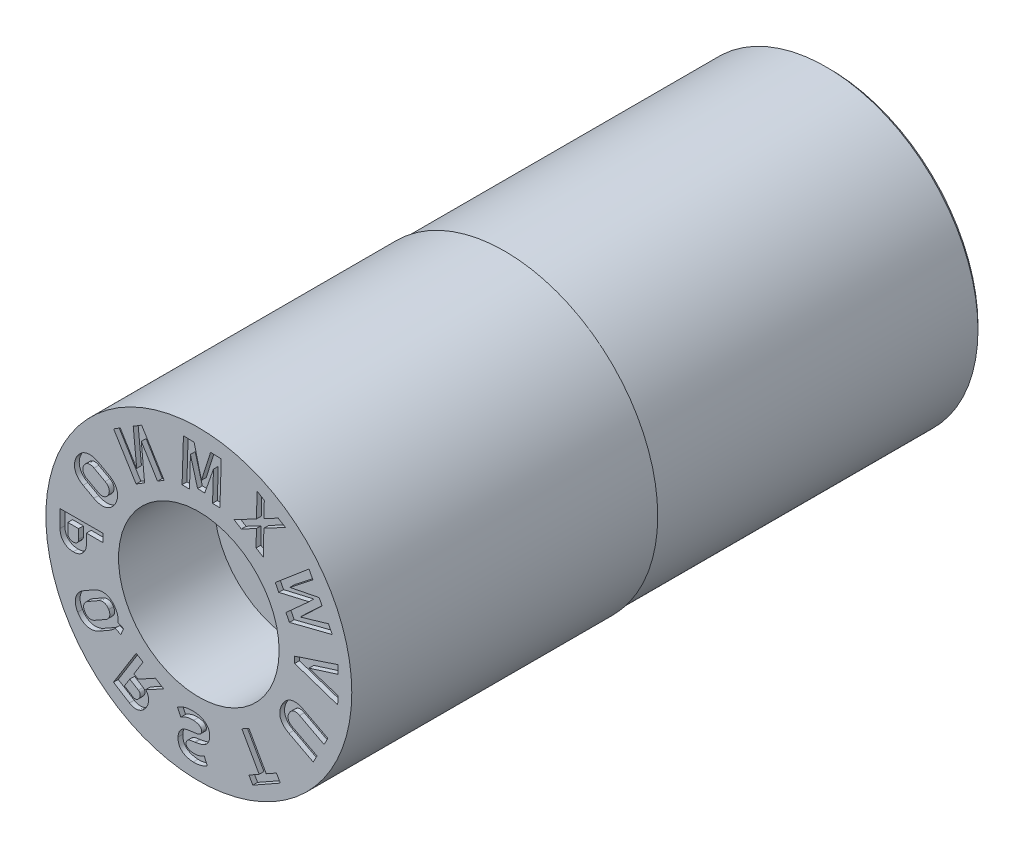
SolidWorks part; units mm, degrees
ref_plane "Front Plane" through (0, 0, 0) normal (0, 0, 1) x (1, 0, 0)
ref_plane "Top Plane" through (0, 0, 0) normal (0, 1, 0) x (1, 0, 0)
ref_plane "Right Plane" through (0, 0, 0) normal (1, 0, 0) x (0, 0, -1)
sketch "Sketch1" plane through (0, 0, 0) normal (1, 0, 0) x (0, 0, -1)
  line L2 (0, 8) -> (0, 4.2)
  line L3 (32.75, 8) -> (0, 8)
  line L4 (-3.7979, 0) -> (49996.2021, 0) construction
  line L8 (25, 1.75) -> (5, 1.75)
  line L9 (5, 4.2) -> (5, 1.75)
  line L10 (5, 4.2) -> (0, 4.2)
  line L12 (33, 4) -> (33, 7.75)
  line L16 (33, 7.75) -> (32.75, 8)
  line L17 (33, 4) -> (25, 4)
  line L18 (25, 1.75) -> (25, 4)
  dimension "D1" = 33
  dimension "D2" = 45
  dimension "D3" = 0.25
  dimension "D4" = 16
  dimension "D5" = 8.4
  dimension "D6" = 5
  dimension "D7" = 3.5
  dimension "D8" = 8
  dimension "D9" = 8
revolve "Revolve1" add sketch "Sketch1" angle 360 about L4
sketch "Sketch4" plane through (0, 0, 0) normal (1, 0, 0) x (0, 0, -1)
  line L0 (0, 0) -> (50000, 0) construction
  line L1 (33, -7.75) -> (33, 7.75) construction
  line L2 (16, 8.935) -> (33, 8.935)
  line L3 (16, 8.935) -> (16, 7.935)
  line L4 (16, 7.935) -> (33, 7.935)
  line L5 (33, 8.935) -> (33, 7.935)
  line L6 (32.75, 8) -> (0, 8) construction
  line L9 (0, 8.8) -> (0, -8.8) construction
  dimension "D1" = 1
  dimension "D2" = 0.065
  dimension "D3" = 16
revolve "Cut-Revolve1" cut sketch "Sketch4" angle 360 about L0
sketch "Sketch2" plane through (0, 0, 0) normal (0, 0, 1) x (1, 0, 0)
  line L0 (0, 0) -> (0, 8) construction
  line L1 (0, 0) -> (4, 6.9282) construction
  line L2 (0, 0) -> (6.9282, 4) construction
  line L3 (0, 0) -> (8, 0) construction
  line L4 (0, 0) -> (6.9282, -4) construction
  line L5 (0, 0) -> (4, -6.9282) construction
  line L6 (0, 0) -> (0, -8) construction
  line L7 (0, 0) -> (-4, -6.9282) construction
  line L8 (0, 0) -> (-6.9282, -4) construction
  line L9 (0, 0) -> (-8, 0) construction
  line L10 (0, 0) -> (-6.9282, 4) construction
  line L11 (0, 0) -> (-4, 6.9282) construction
  line L12 (6.4488, 3.1517) -> (6.2927, 3.4546)
  line L13 (6.2927, 3.4546) -> (4.7601, 3.1497)
  line L14 (4.7601, 3.1497) -> (5.9631, 4.095)
  line L15 (5.9631, 4.095) -> (5.7632, 4.4834)
  line L16 (5.7632, 4.4834) -> (3.9985, 2.9908)
  line L17 (3.9985, 2.9908) -> (4.1813, 2.6355)
  line L18 (4.1813, 2.6355) -> (5.7635, 3.0009)
  line L19 (5.7635, 3.0009) -> (4.556, 1.9087)
  line L20 (4.556, 1.9087) -> (4.7388, 1.5533)
  line L21 (4.7388, 1.5533) -> (6.9783, 2.1228)
  line L22 (6.9783, 2.1228) -> (6.7784, 2.5113)
  line L23 (6.7784, 2.5113) -> (5.3101, 2.0809)
  line L24 (5.3101, 2.0809) -> (6.4488, 3.1517)
  line L25 (3.1563, -6.1177) -> (2.6213, -6.4193)
  line L26 (3.4004, 5.1489) -> (4.5318, 5.7499)
  line L27 (4.5318, 5.7499) -> (4.1504, 5.9824)
  line L28 (4.1504, 5.9824) -> (3.4083, 5.5883)
  line L29 (-3.1769, -4.9777) -> (-3.3944, -4.8422)
  line L30 (3.0187, 5.3802) -> (1.8422, 4.7562)
  line L31 (1.8422, 4.7562) -> (2.2238, 4.5234)
  line L32 (2.2238, 4.5234) -> (3.0109, 4.942)
  line L33 (3.4083, 5.5883) -> (3.4236, 6.4254)
  line L34 (3.4236, 6.4254) -> (3.042, 6.6583)
  line L35 (3.042, 6.6583) -> (3.0187, 5.3802)
  line L36 (3.0109, 4.942) -> (2.9951, 4.0531)
  line L37 (2.9951, 4.0531) -> (3.3767, 3.8203)
  line L38 (3.3767, 3.8203) -> (3.4004, 5.1489)
  line L39 (-0.2451, 7.2204) -> (-0.8048, 7.2379)
  line L40 (-0.8048, 7.2379) -> (-0.8743, 4.9851)
  line L41 (-0.8743, 4.9851) -> (-0.4882, 4.9734)
  line L42 (-0.4882, 4.9734) -> (-0.4388, 6.5719)
  line L43 (-3.3944, -4.8422) -> (-2.9167, -4.0755)
  line L44 (-0.4388, 6.5719) -> (-0.0653, 5.2113)
  line L45 (-0.0653, 5.2113) -> (0.3098, 5.1998)
  line L46 (0.3098, 5.1998) -> (0.766, 6.5083)
  line L47 (-5.8797, 0.289) -> (-5.0054, 0.2907)
  line L48 (0.766, 6.5083) -> (0.7173, 4.9359)
  line L49 (0.7173, 4.9359) -> (1.103, 4.9242)
  line L50 (1.103, 4.9242) -> (1.1726, 7.177)
  line L51 (1.1726, 7.177) -> (0.6134, 7.194)
  line L52 (0.6134, 7.194) -> (0.1374, 5.6892)
  line L53 (0.1374, 5.6892) -> (-0.2451, 7.2204)
  line L54 (-2.9895, 6.624) -> (-3.4305, 6.353)
  line L55 (-3.4305, 6.353) -> (-3.2499, 4.5344)
  line L57 (-3.2499, 4.5344) -> (-4.1103, 5.9352)
  line L58 (-4.1103, 5.9352) -> (-4.4551, 5.7231)
  line L59 (-4.4551, 5.7231) -> (-3.2803, 3.8113)
  line L60 (-3.2803, 3.8113) -> (-2.8369, 4.084)
  line L61 (-2.8369, 4.084) -> (-3.0069, 5.88)
  line L63 (-3.0069, 5.88) -> (-2.1593, 4.5005)
  line L64 (-2.1593, 4.5005) -> (-1.8148, 4.7122)
  line L65 (-1.8148, 4.7122) -> (-2.9895, 6.624)
  line L66 (-4.698, 3.5076) -> (-5.2593, 3.8155)
  line L67 (-6.0526, 2.368) -> (-5.4913, 2.0601)
  line L68 (-5.2693, 2.4418) -> (-5.8502, 2.7599)
  line L69 (-5.4811, 3.4334) -> (-4.9001, 3.1152)
  line L70 (-6.2889, 0.2881) -> (-6.2881, -0.2013)
  line L71 (-6.8488, -0.2025) -> (-6.8496, 0.287)
  line L73 (-7.2597, 0.7109) -> (-7.258, -0.1928)
  line L74 (-5.879, -0.1898) -> (-5.8797, 0.289)
  line L77 (-6.8496, 0.287) -> (-6.2889, 0.2881)
  line L78 (-5.0054, 0.2907) -> (-5.0064, 0.7155)
  line L79 (-5.0064, 0.7155) -> (-7.2597, 0.7109)
  line L81 (-4.3848, -3.2727) -> (-4.074, -3.4053)
  line L82 (-4.074, -3.4053) -> (-3.9364, -3.0669)
  line L83 (-3.9364, -3.0669) -> (-4.2324, -2.9411)
  line L84 (-5.4709, -2.0766) -> (-6.0236, -2.3918)
  line L85 (-5.2103, -3.8157) -> (-4.6577, -3.5005)
  line L86 (-4.8657, -3.1144) -> (-5.4372, -3.4405)
  line L87 (-5.8155, -2.7779) -> (-5.244, -2.4518)
  line L88 (-3.6097, -5.1879) -> (-3.1634, -5.466)
  line L89 (-3.4425, -5.9138) -> (-3.8888, -5.6357)
  line L94 (-4.4632, -5.7578) -> (-3.6292, -6.2777)
  line L95 (-3.8888, -5.6357) -> (-3.6097, -5.1879)
  line L96 (-2.9167, -4.0755) -> (-3.2757, -3.8518)
  line L97 (-3.2757, -3.8518) -> (-4.4632, -5.7578)
  line L99 (-2.7792, -5.2514) -> (-1.8346, -4.7498)
  line L100 (-1.8346, -4.7498) -> (-2.2696, -4.4786)
  line L101 (-2.2696, -4.4786) -> (-3.1769, -4.9777)
  line L102 (-1.1164, -5.2148) -> (-0.94, -5.5761)
  line L103 (0.1443, -5.6846) -> (0.1442, -5.686)
  line L104 (-0.2833, -5.9301) -> (-0.3172, -5.9329)
  line L105 (-1.0856, -6.5477) -> (-1.0858, -6.5495)
  line L106 (0.4412, -7.0932) -> (0.2821, -6.7239)
  line L107 (-0.6669, -6.6131) -> (-0.6668, -6.6118)
  line L108 (0.5649, -5.7198) -> (0.5647, -5.7165)
  line L110 (3.5259, -5.9094) -> (2.6203, -4.3023)
  line L111 (2.6203, -4.3023) -> (2.2508, -4.5108)
  line L112 (2.2508, -4.5108) -> (3.1563, -6.1177)
  line L113 (2.8222, -6.7759) -> (4.2615, -5.9646)
  line L114 (4.2615, -5.9646) -> (4.0606, -5.608)
  line L115 (4.0606, -5.608) -> (3.5259, -5.9094)
  line L116 (2.6213, -6.4193) -> (2.8222, -6.7759)
  line L117 (4.7119, -3.4825) -> (5.9837, -4.1508)
  line L118 (5.9837, -4.1508) -> (6.1811, -3.7754)
  line L119 (6.1811, -3.7754) -> (4.8997, -3.1024)
  line L120 (5.2697, -2.3976) -> (6.5511, -3.0707)
  line L121 (6.5511, -3.0707) -> (6.7483, -2.6948)
  line L122 (6.7483, -2.6948) -> (5.4765, -2.0265)
  line L123 (7.2657, -0.9258) -> (7.267, -0.4886)
  line L124 (7.267, -0.4886) -> (5.7651, -0.0058)
  line L125 (5.7651, -0.0058) -> (7.2693, 0.4689)
  line L126 (7.2693, 0.4689) -> (7.2706, 0.906)
  line L127 (7.2706, 0.906) -> (5.0153, 0.1623)
  line L128 (5.0153, 0.1623) -> (5.0142, -0.1697)
  line L129 (5.0142, -0.1697) -> (7.2657, -0.9258)
  circle A0 centre (0, 0) radius 5.0987 construction
  circle A1 centre (0, 0) radius 8 construction
  spline S0 degree 3 poles (-4.3634, 2.3836) (-4.344, 2.4183) (-4.3186, 2.4716) (-4.2912, 2.5443) (-4.2747, 2.598) (-4.2619, 2.6517) (-4.2525, 2.7053) (-4.2476, 2.7591) (-4.2456, 2.8123) (-4.2478, 2.8652) (-4.2532, 2.9172) (-4.262, 2.9684) (-4.2759, 3.0182) (-4.2915, 3.0674) (-4.3119, 3.1153) (-4.336, 3.162) (-4.3628, 3.2081) (-4.394, 3.2518) (-4.4275, 3.2946) (-4.4649, 3.3349) (-4.5055, 3.3733) (-4.5486, 3.4104) (-4.6119, 3.4569) (-4.6627, 3.4882) (-4.698, 3.5076) knots 0 0 0 0 0.090417 0.133864 0.176276 0.217818 0.259154 0.299759 0.340251 0.380131 0.419768 0.458883 0.497906 0.537021 0.576163 0.61597 0.656312 0.697015 0.737895 0.779553 0.821787 0.864666 0.908561 1 1 1 1
  spline S1 degree 3 poles (-5.2593, 3.8155) (-5.2948, 3.8344) (-5.3481, 3.8615) (-5.4218, 3.8885) (-5.4759, 3.9057) (-5.5301, 3.9189) (-5.5842, 3.9287) (-5.6382, 3.9339) (-5.6918, 3.9365) (-5.7449, 3.9342) (-5.7971, 3.9299) (-5.8482, 3.9204) (-5.8983, 3.908) (-5.9475, 3.8921) (-5.9953, 3.8721) (-6.0425, 3.8495) (-6.088, 3.8223) (-6.1319, 3.7919) (-6.1746, 3.7589) (-6.2148, 3.7221) (-6.2532, 3.6823) (-6.2896, 3.6393) (-6.3361, 3.5771) (-6.3671, 3.527) (-6.3862, 3.4921) knots 0 0 0 0 0.091509 0.13546 0.178154 0.220455 0.262042 0.302878 0.343583 0.383955 0.423455 0.462585 0.501839 0.540633 0.57985 0.619401 0.659411 0.700117 0.740632 0.781904 0.823734 0.866298 0.909762 1 1 1 1
  spline S2 degree 3 poles (-6.3862, 3.4921) (-6.4056, 3.4574) (-6.431, 3.404) (-6.4584, 3.3313) (-6.4748, 3.2775) (-6.4883, 3.224) (-6.4968, 3.1701) (-6.5025, 3.1165) (-6.5043, 3.0629) (-6.5026, 3.0099) (-6.4964, 2.9578) (-6.4875, 2.9068) (-6.4748, 2.8569) (-6.4583, 2.808) (-6.4379, 2.7603) (-6.4148, 2.7132) (-6.387, 2.668) (-6.3569, 2.6235) (-6.3224, 2.5815) (-6.2858, 2.5405) (-6.2451, 2.5023) (-6.202, 2.4651) (-6.1387, 2.4186) (-6.0879, 2.3874) (-6.0526, 2.368) knots 0 0 0 0 0.090428 0.133879 0.176296 0.218093 0.259201 0.300026 0.340522 0.380882 0.420369 0.459489 0.498292 0.537327 0.576473 0.615974 0.65631 0.697004 0.737925 0.779528 0.821767 0.864651 0.908551 1 1 1 1
  spline S3 degree 3 poles (-5.4913, 2.0601) (-5.4558, 2.0412) (-5.4025, 2.014) (-5.3287, 1.9871) (-5.2747, 1.9693) (-5.2204, 1.9568) (-5.1662, 1.9468) (-5.112, 1.9414) (-5.0582, 1.9392) (-5.0051, 1.9401) (-4.9529, 1.946) (-4.9017, 1.9545) (-4.8515, 1.9668) (-4.8024, 1.983) (-4.7543, 2.0027) (-4.7074, 2.0262) (-4.6617, 2.0532) (-4.6177, 2.0837) (-4.575, 2.1167) (-4.5348, 2.1535) (-4.4964, 2.1934) (-4.46, 2.2363) (-4.4135, 2.2985) (-4.3825, 2.3487) (-4.3634, 2.3836) knots 0 0 0 0 0.091419 0.135326 0.178245 0.220253 0.261799 0.303083 0.343748 0.38396 0.423573 0.462799 0.501686 0.540778 0.579956 0.619429 0.659747 0.700413 0.740888 0.782119 0.823908 0.86643 0.909851 1 1 1 1
  spline S4 degree 3 poles (-4.7373, 2.5883) (-4.7555, 2.5571) (-4.7846, 2.5116) (-4.8359, 2.4637) (-4.8762, 2.4335) (-4.9202, 2.4108) (-4.966, 2.3936) (-5.0144, 2.3847) (-5.0644, 2.3823) (-5.1157, 2.386) (-5.186, 2.402) (-5.2369, 2.4233) (-5.2693, 2.4418) knots 0 0 0 0 0.175066 0.257026 0.337672 0.416954 0.494877 0.572754 0.653437 0.735689 0.820268 1 1 1 1
  spline S5 degree 3 poles (-5.8502, 2.7599) (-5.883, 2.7776) (-5.9281, 2.8092) (-5.9796, 2.8595) (-6.0105, 2.9007) (-6.036, 2.9439) (-6.0534, 2.9899) (-6.0648, 3.0375) (-6.0683, 3.0869) (-6.0652, 3.1371) (-6.052, 3.2062) (-6.03, 3.2556) (-6.013, 3.2876) knots 0 0 0 0 0.179291 0.263984 0.346173 0.426703 0.505006 0.582502 0.662079 0.742384 0.824865 1 1 1 1
  spline S6 degree 3 poles (-6.013, 3.2876) (-5.9956, 3.3194) (-5.9648, 3.3634) (-5.9144, 3.4123) (-5.8741, 3.4421) (-5.8303, 3.465) (-5.7844, 3.4814) (-5.736, 3.4905) (-5.6859, 3.493) (-5.6346, 3.4889) (-5.5645, 3.4722) (-5.5134, 3.4521) (-5.4811, 3.4334) knots 0 0 0 0 0.175013 0.257189 0.337906 0.416522 0.494678 0.572624 0.653378 0.736149 0.820282 1 1 1 1
  spline S7 degree 3 poles (-4.9001, 3.1152) (-4.8673, 3.0974) (-4.8223, 3.0658) (-4.7706, 3.0156) (-4.7399, 2.9745) (-4.7144, 2.9313) (-4.6969, 2.8853) (-4.6856, 2.8378) (-4.6819, 2.7888) (-4.6849, 2.7385) (-4.6989, 2.6696) (-4.7198, 2.62) (-4.7373, 2.5883) knots 0 0 0 0 0.180158 0.264225 0.346507 0.427127 0.505518 0.583101 0.661767 0.742163 0.825247 1 1 1 1
  spline S8 degree 3 poles (-6.2881, -0.2013) (-6.2881, -0.2253) (-6.2916, -0.2611) (-6.3064, -0.3056) (-6.3216, -0.336) (-6.3407, -0.3637) (-6.3636, -0.3883) (-6.3903, -0.4095) (-6.4204, -0.4273) (-6.4534, -0.4418) (-6.5019, -0.4558) (-6.5403, -0.4595) (-6.5663, -0.4595) knots 0 0 0 0 0.169434 0.250086 0.328532 0.407346 0.485755 0.563905 0.646402 0.730758 0.816935 1 1 1 1
  spline S9 degree 3 poles (-6.5663, -0.4595) (-6.5926, -0.4598) (-6.6315, -0.4565) (-6.6808, -0.443) (-6.7143, -0.4291) (-6.7447, -0.4114) (-6.7716, -0.3905) (-6.7948, -0.3662) (-6.8143, -0.3386) (-6.8298, -0.3082) (-6.8444, -0.2631) (-6.8485, -0.227) (-6.8488, -0.2025) knots 0 0 0 0 0.183737 0.270259 0.35493 0.436774 0.514306 0.592094 0.670285 0.749063 0.828741 1 1 1 1
  spline S10 degree 3 poles (-7.258, -0.1928) (-7.2583, -0.2595) (-7.2474, -0.3573) (-7.2114, -0.4805) (-7.1735, -0.5639) (-7.1257, -0.6395) (-7.069, -0.707) (-7.0031, -0.765) (-6.9291, -0.814) (-6.8472, -0.8526) (-6.7267, -0.8904) (-6.6303, -0.8991) (-6.5653, -0.8994) knots 0 0 0 0 0.179428 0.263192 0.344951 0.425149 0.503595 0.58156 0.660922 0.741878 0.824548 1 1 1 1
  spline S11 degree 3 poles (-6.5653, -0.8994) (-6.5003, -0.8992) (-6.4042, -0.8899) (-6.2843, -0.8514) (-6.2034, -0.8122) (-6.1297, -0.7634) (-6.0641, -0.7053) (-6.008, -0.6375) (-5.9612, -0.5612) (-5.9239, -0.4775) (-5.8875, -0.3543) (-5.8788, -0.2562) (-5.879, -0.1898) knots 0 0 0 0 0.17567 0.257978 0.338538 0.417594 0.495743 0.574022 0.654373 0.736457 0.820616 1 1 1 1
  spline S12 degree 3 poles (-4.3457, -2.3777) (-4.3651, -2.3434) (-4.3973, -2.2944) (-4.444, -2.2331) (-4.4811, -2.1911) (-4.52, -2.1525) (-4.5608, -2.1168) (-4.6035, -2.0844) (-4.6479, -2.0552) (-4.6937, -2.0297) (-4.7405, -2.0071) (-4.7883, -1.9882) (-4.8374, -1.9732) (-4.8873, -1.9615) (-4.9386, -1.9541) (-4.9905, -1.9498) (-5.0434, -1.9492) (-5.0967, -1.9516) (-5.1502, -1.9592) (-5.2039, -1.9689) (-5.2574, -1.9833) (-5.3109, -2.0009) (-5.3832, -2.0302) (-5.4362, -2.0566) (-5.4709, -2.0766) knots 0 0 0 0 0.090234 0.133861 0.176167 0.218114 0.259198 0.299947 0.340551 0.380505 0.419966 0.45916 0.497959 0.537253 0.576271 0.616191 0.656407 0.697093 0.738095 0.779698 0.821795 0.864815 0.90843 1 1 1 1
  spline S13 degree 3 poles (-6.0236, -2.3918) (-6.0582, -2.4118) (-6.1083, -2.4437) (-6.17, -2.4914) (-6.2126, -2.5284) (-6.2519, -2.5675) (-6.2882, -2.6084) (-6.3211, -2.6511) (-6.3508, -2.6955) (-6.3771, -2.7414) (-6.3996, -2.7885) (-6.4192, -2.8363) (-6.4342, -2.8853) (-6.446, -2.9352) (-6.4549, -2.9859) (-6.4591, -3.0378) (-6.4604, -3.0905) (-6.4576, -3.1435) (-6.4513, -3.1967) (-6.4414, -3.2497) (-6.4271, -3.3028) (-6.41, -3.3559) (-6.3814, -3.4276) (-6.3553, -3.4801) (-6.3354, -3.5142) knots 0 0 0 0 0.09146 0.135407 0.17814 0.220498 0.261975 0.303097 0.343701 0.38398 0.423782 0.462904 0.502035 0.540876 0.579933 0.619684 0.659711 0.700389 0.74094 0.78204 0.823635 0.866377 0.909701 1 1 1 1
  spline S14 degree 3 poles (-6.3354, -3.5142) (-6.3159, -3.5486) (-6.2837, -3.5975) (-6.237, -3.659) (-6.1997, -3.7008) (-6.161, -3.7396) (-6.1201, -3.775) (-6.0779, -3.808) (-6.0333, -3.8371) (-5.9873, -3.8628) (-5.9404, -3.8855) (-5.8926, -3.9043) (-5.8436, -3.9194) (-5.7936, -3.9308) (-5.7427, -3.9385) (-5.6908, -3.9429) (-5.638, -3.9437) (-5.5846, -3.9403) (-5.5311, -3.9341) (-5.4774, -3.9237) (-5.4241, -3.909) (-5.3703, -3.8917) (-5.2978, -3.8627) (-5.2451, -3.8353) (-5.2103, -3.8157) knots 0 0 0 0 0.090218 0.133837 0.176472 0.21807 0.259147 0.29992 0.340517 0.380813 0.420268 0.459455 0.498247 0.537204 0.576536 0.615976 0.656185 0.697067 0.738109 0.779449 0.821796 0.864538 0.908634 1 1 1 1
  spline S15 degree 3 poles (-4.6577, -3.5005) (-4.623, -3.4805) (-4.573, -3.4486) (-4.5112, -3.4009) (-4.4687, -3.3637) (-4.4293, -3.3247) (-4.402, -3.2939) (-4.3877, -3.2763) (-4.3848, -3.2727) knots 0 0 0 0 0.091434 0.135369 0.178426 0.220431 0.261896 0.272358 0.272358 0.272358 0.272358
  spline S16 degree 3 poles (-4.7134, -2.5876) (-4.6956, -2.619) (-4.6737, -2.6678) (-4.6587, -2.7361) (-4.6547, -2.786) (-4.6578, -2.8349) (-4.6672, -2.8825) (-4.6849, -2.9281) (-4.7086, -2.9718) (-4.7389, -3.0127) (-4.7888, -3.064) (-4.8332, -3.0964) (-4.8657, -3.1144) knots 0 0 0 0 0.175071 0.257562 0.338258 0.41707 0.494906 0.573014 0.653432 0.735383 0.819614 1 1 1 1
  spline S17 degree 3 poles (-5.4372, -3.4405) (-5.4692, -3.4592) (-5.5192, -3.4813) (-5.5888, -3.4983) (-5.6397, -3.5033) (-5.6895, -3.5023) (-5.7375, -3.4933) (-5.7835, -3.478) (-5.8272, -3.4557) (-5.8683, -3.4271) (-5.9189, -3.379) (-5.9507, -3.336) (-5.9683, -3.3044) knots 0 0 0 0 0.179631 0.263716 0.346819 0.427114 0.504808 0.582853 0.661977 0.742324 0.824817 1 1 1 1
  spline S18 degree 3 poles (-5.9683, -3.3044) (-5.9867, -3.2734) (-6.0071, -3.2243) (-6.023, -3.1565) (-6.0267, -3.1067) (-6.024, -3.0577) (-6.0134, -3.0102) (-5.9966, -2.9642) (-5.9726, -2.9204) (-5.9422, -2.8793) (-5.8924, -2.8279) (-5.8475, -2.7965) (-5.8155, -2.7779) knots 0 0 0 0 0.174598 0.256604 0.33734 0.416193 0.494507 0.572807 0.653266 0.736 0.820274 1 1 1 1
  spline S19 degree 3 poles (-5.244, -2.4518) (-5.2121, -2.4329) (-5.1617, -2.4114) (-5.0923, -2.3942) (-5.0416, -2.3894) (-4.9919, -2.3903) (-4.944, -2.3997) (-4.8978, -2.4147) (-4.8542, -2.437) (-4.8133, -2.4657) (-4.762, -2.5128) (-4.7316, -2.5568) (-4.7134, -2.5876) knots 0 0 0 0 0.180338 0.264553 0.346739 0.427158 0.505663 0.583106 0.662351 0.742822 0.825304 1 1 1 1
  spline S20 degree 3 poles (-3.1634, -5.466) (-3.1458, -5.4768) (-3.1218, -5.4961) (-3.097, -5.5281) (-3.083, -5.5539) (-3.0727, -5.5816) (-3.0658, -5.6108) (-3.0647, -5.6418) (-3.0668, -5.6738) (-3.0738, -5.7065) (-3.0875, -5.7521) (-3.1042, -5.7848) (-3.1171, -5.8061) knots 0 0 0 0 0.160612 0.237098 0.313463 0.389061 0.466581 0.546139 0.629588 0.716199 0.805606 1 1 1 1
  spline S21 degree 3 poles (-3.1171, -5.8061) (-3.1297, -5.8274) (-3.1525, -5.8557) (-3.1858, -5.8895) (-3.2123, -5.9096) (-3.24, -5.9256) (-3.2681, -5.9382) (-3.2974, -5.9455) (-3.3267, -5.9487) (-3.3564, -5.9469) (-3.3964, -5.9385) (-3.4248, -5.925) (-3.4425, -5.9138) knots 0 0 0 0 0.191933 0.281905 0.367825 0.450098 0.529993 0.606815 0.683304 0.759048 0.836941 1 1 1 1
  spline S22 degree 3 poles (-3.6292, -6.2777) (-3.5794, -6.3082) (-3.5012, -6.347) (-3.3905, -6.3732) (-3.3087, -6.3812) (-3.2278, -6.3774) (-3.1485, -6.3616) (-3.0715, -6.3346) (-2.9976, -6.2956) (-2.9268, -6.2466) (-2.8378, -6.1638) (-2.7803, -6.0904) (-2.7476, -6.0363) knots 0 0 0 0 0.170748 0.251497 0.330741 0.409456 0.486886 0.565662 0.64645 0.72983 0.816027 1 1 1 1
  spline S23 degree 3 poles (-2.7476, -6.0363) (-2.7148, -5.9824) (-2.6714, -5.8995) (-2.6381, -5.7824) (-2.6241, -5.6971) (-2.6225, -5.6133) (-2.6314, -5.5319) (-2.653, -5.4541) (-2.6855, -5.3797) (-2.7277, -5.3115) (-2.7616, -5.2703) (-2.7792, -5.2514) knots 0 0 0 0 0.184404 0.270267 0.353973 0.435404 0.513884 0.591754 0.669953 0.749645 0.824899 0.824899 0.824899 0.824899
  spline S24 degree 3 poles (-0.2539, -4.9842) (-0.3072, -4.9806) (-0.3869, -4.9807) (-0.4925, -4.9882) (-0.5706, -4.9979) (-0.6472, -5.0121) (-0.7221, -5.0295) (-0.7947, -5.0515) (-0.8652, -5.0771) (-0.9329, -5.1065) (-1.0187, -5.1488) (-1.0786, -5.1871) (-1.1164, -5.2148) knots 0 0 0 0 0.175816 0.262253 0.349054 0.434999 0.519088 0.602387 0.684996 0.76606 0.845593 1 1 1 1
  spline S25 degree 3 poles (-0.94, -5.5761) (-0.8945, -5.5425) (-0.8206, -5.4991) (-0.7146, -5.4542) (-0.6304, -5.4273) (-0.5435, -5.407) (-0.4259, -5.3884) (-0.3364, -5.3873) (-0.2772, -5.3902) knots 0 0 0 0 0.241564 0.36485 0.491535 0.619246 0.746088 1 1 1 1
  spline S26 degree 3 poles (-0.2772, -5.3902) (-0.2445, -5.3927) (-0.1967, -5.3962) (-0.1359, -5.4079) (-0.0943, -5.4174) (-0.056, -5.4297) (-0.0207, -5.4442) (0.0119, -5.4598) (0.0408, -5.4784) (0.0671, -5.498) (0.0891, -5.5202) (0.1079, -5.5436) (0.1229, -5.5687) (0.1338, -5.5954) (0.1444, -5.6337) (0.1456, -5.6642) (0.1443, -5.6846) knots 0 0 0 0 0.170714 0.249203 0.322517 0.39276 0.45861 0.520967 0.580889 0.637532 0.691348 0.743244 0.793496 0.843085 0.893306 1 1 1 1
  spline S27 degree 3 poles (0.1442, -5.686) (0.1425, -5.7132) (0.135, -5.753) (0.1102, -5.7991) (0.0857, -5.8268) (0.0566, -5.8499) (0.0235, -5.8689) (-0.0129, -5.8847) (-0.0535, -5.8965) (-0.0987, -5.9061) (-0.1698, -5.9172) (-0.226, -5.9245) (-0.2655, -5.928) knots 0 0 0 0 0.155958 0.226205 0.294878 0.365125 0.436938 0.511413 0.590371 0.677175 0.774387 1 1 1 1
  spline S28 degree 3 poles (-0.2655, -5.928) (-0.2685, -5.9286) (-0.2743, -5.93) (-0.2804, -5.9294) (-0.2833, -5.9301) knots 0 0 0 0 0.505222 1 1 1 1
  spline S29 degree 3 poles (-0.3172, -5.9329) (-0.3871, -5.9406) (-0.4876, -5.9524) (-0.6139, -5.9782) (-0.696, -5.9989) (-0.7712, -6.0264) (-0.8403, -6.0653) (-0.904, -6.1142) (-0.9525, -6.1629) (-0.9873, -6.2076) (-1.0105, -6.2454) (-1.0312, -6.2866) (-1.048, -6.3318) (-1.0622, -6.3806) (-1.0777, -6.4525) (-1.0831, -6.509) (-1.0856, -6.5477) knots 0 0 0 0 0.19074 0.273951 0.349023 0.420088 0.490514 0.56274 0.637321 0.676109 0.715999 0.757372 0.800855 0.8465 0.894975 1 1 1 1
  spline S30 degree 3 poles (-1.0858, -6.5495) (-1.0879, -6.5847) (-1.0883, -6.6367) (-1.0813, -6.7046) (-1.0733, -6.7529) (-1.0626, -6.7997) (-1.0481, -6.8444) (-1.0309, -6.8874) (-1.0102, -6.9284) (-0.9865, -6.9676) (-0.96, -7.0046) (-0.9307, -7.0396) (-0.8981, -7.0718) (-0.8629, -7.1027) (-0.8245, -7.1308) (-0.7835, -7.1575) (-0.7394, -7.1811) (-0.6929, -7.2032) (-0.6436, -7.2223) (-0.5918, -7.2392) (-0.5375, -7.2532) (-0.4806, -7.2654) (-0.4, -7.2794) (-0.3375, -7.2842) (-0.2952, -7.2871) knots 0 0 0 0 0.086122 0.126937 0.166794 0.205856 0.244094 0.281595 0.319089 0.356297 0.393447 0.430238 0.467716 0.505529 0.544495 0.584174 0.624919 0.666716 0.709957 0.754089 0.799996 0.84712 0.896298 1 1 1 1
  spline S31 degree 3 poles (-0.2952, -7.2871) (-0.2546, -7.2896) (-0.1927, -7.2897) (-0.1099, -7.2825) (-0.0251, -7.2714) (0.0808, -7.2484) (0.2473, -7.1957) (0.366, -7.1381) (0.4412, -7.0932) knots 0 0 0 0 0.158254 0.239769 0.322694 0.490228 0.659934 1 1 1 1
  spline S32 degree 3 poles (0.2821, -6.7239) (0.2381, -6.7515) (0.1693, -6.7867) (0.0746, -6.8253) (0.0035, -6.8488) (-0.0675, -6.866) (-0.159, -6.8815) (-0.2275, -6.8838) (-0.272, -6.8816) knots 0 0 0 0 0.266015 0.396017 0.524444 0.649904 0.7709 1 1 1 1
  spline S33 degree 3 poles (-0.272, -6.8816) (-0.3028, -6.8797) (-0.3473, -6.8751) (-0.4047, -6.8659) (-0.4433, -6.8561) (-0.4793, -6.845) (-0.5125, -6.8323) (-0.5429, -6.8177) (-0.5701, -6.8007) (-0.5944, -6.7825) (-0.6152, -6.7626) (-0.6326, -6.7412) (-0.6466, -6.7184) (-0.657, -6.694) (-0.6663, -6.6591) (-0.668, -6.6316) (-0.6669, -6.6131) knots 0 0 0 0 0.172995 0.251527 0.326367 0.39674 0.462928 0.526374 0.586019 0.642841 0.696728 0.747231 0.797654 0.846549 0.896098 1 1 1 1
  spline S34 degree 3 poles (-0.6668, -6.6118) (-0.6646, -6.5824) (-0.6578, -6.5387) (-0.6296, -6.4896) (-0.6028, -6.4601) (-0.5717, -6.4353) (-0.5371, -6.415) (-0.4998, -6.3978) (-0.4581, -6.3851) (-0.411, -6.3743) (-0.3331, -6.3589) (-0.2702, -6.3501) (-0.2255, -6.3436) knots 0 0 0 0 0.156636 0.226717 0.295979 0.365626 0.435539 0.507128 0.581643 0.665116 0.76192 1 1 1 1
  spline S35 degree 3 poles (-0.2255, -6.3436) (-0.2216, -6.3424) (-0.2132, -6.3429) (-0.205, -6.3411) (-0.2008, -6.3403) knots 0 0 0 0 0.487223 1 1 1 1
  spline S36 degree 3 poles (-0.2008, -6.3403) (-0.1947, -6.3398) (-0.1824, -6.3383) (-0.1705, -6.3349) (-0.1643, -6.3345) knots 0 0 0 0 0.496914 1 1 1 1
  spline S37 degree 3 poles (-0.1643, -6.3345) (-0.0978, -6.325) (-0.0023, -6.3092) (0.1178, -6.2789) (0.1968, -6.2555) (0.2693, -6.225) (0.3351, -6.1844) (0.3956, -6.135) (0.4409, -6.0864) (0.4732, -6.0423) (0.495, -6.0056) (0.5139, -5.9656) (0.5299, -5.9226) (0.5427, -5.8765) (0.5573, -5.809) (0.5628, -5.756) (0.5649, -5.7198) knots 0 0 0 0 0.189525 0.27287 0.349568 0.421868 0.4941 0.566805 0.64198 0.680728 0.720921 0.762333 0.8053 0.850122 0.897545 1 1 1 1
  spline S38 degree 3 poles (0.5647, -5.7165) (0.5669, -5.6819) (0.5671, -5.6304) (0.5602, -5.5632) (0.5517, -5.5155) (0.5403, -5.4693) (0.5255, -5.425) (0.507, -5.3827) (0.4861, -5.3418) (0.4613, -5.3031) (0.4338, -5.2663) (0.4032, -5.2316) (0.3698, -5.1989) (0.3331, -5.1688) (0.2936, -5.1405) (0.2508, -5.1147) (0.2055, -5.0904) (0.1569, -5.069) (0.106, -5.0495) (0.0522, -5.0327) (-0.0039, -5.0176) (-0.0629, -5.0061) (-0.1462, -4.9925) (-0.2104, -4.9871) (-0.2539, -4.9842) knots 0 0 0 0 0.083789 0.123659 0.162686 0.20061 0.238111 0.275096 0.31194 0.348767 0.385598 0.422661 0.460174 0.498141 0.536996 0.577259 0.618441 0.660912 0.704955 0.749898 0.796665 0.844907 0.894828 1 1 1 1
  spline S39 degree 3 poles (4.3518, -2.3668) (4.3321, -2.4038) (4.3066, -2.46) (4.2778, -2.5356) (4.2609, -2.5909) (4.2483, -2.6455) (4.2389, -2.6994) (4.2335, -2.7526) (4.2318, -2.8052) (4.234, -2.857) (4.2401, -2.9078) (4.2496, -2.9574) (4.2634, -3.0057) (4.2806, -3.0528) (4.3017, -3.0988) (4.3263, -3.1439) (4.3553, -3.1875) (4.3877, -3.23) (4.4235, -3.2709) (4.4628, -3.3104) (4.5057, -3.348) (4.5524, -3.384) (4.6197, -3.4313) (4.6742, -3.4628) (4.7119, -3.4825) knots 0 0 0 0 0.094125 0.138681 0.18193 0.224057 0.264753 0.304922 0.344273 0.383012 0.421356 0.459208 0.496674 0.534096 0.572029 0.610348 0.649602 0.689664 0.730372 0.771904 0.814849 0.858626 0.904343 1 1 1 1
  spline S40 degree 3 poles (4.8997, -3.1024) (4.8726, -3.0881) (4.8344, -3.0646) (4.789, -3.0281) (4.759, -3.0005) (4.7342, -2.9698) (4.7124, -2.9384) (4.6948, -2.9052) (4.6812, -2.8705) (4.6715, -2.8346) (4.6665, -2.7978) (4.6654, -2.7603) (4.6689, -2.722) (4.6758, -2.6828) (4.692, -2.6282) (4.7095, -2.5881) (4.7234, -2.5618) knots 0 0 0 0 0.142154 0.207298 0.270184 0.330982 0.389959 0.447713 0.504971 0.562479 0.619685 0.677066 0.736316 0.79763 0.861582 1 1 1 1
  spline S41 degree 3 poles (4.7234, -2.5618) (4.7374, -2.5353) (4.7604, -2.4976) (4.7967, -2.4532) (4.8246, -2.4243) (4.8549, -2.4002) (4.8862, -2.3789) (4.9199, -2.3623) (4.9549, -2.3494) (4.9912, -2.3408) (5.0285, -2.3366) (5.0667, -2.336) (5.1059, -2.3398) (5.1458, -2.3483) (5.2017, -2.3648) (5.2428, -2.3831) (5.2697, -2.3976) knots 0 0 0 0 0.138458 0.203137 0.264776 0.323859 0.381894 0.43957 0.49691 0.553988 0.61159 0.670102 0.730559 0.793113 0.858359 1 1 1 1
  spline S42 degree 3 poles (5.4765, -2.0265) (5.4392, -2.0061) (5.3817, -1.9805) (5.3047, -1.9509) (5.2482, -1.9337) (5.193, -1.9194) (5.1381, -1.9101) (5.0842, -1.9029) (5.0308, -1.9011) (4.9785, -1.9024) (4.9272, -1.9078) (4.877, -1.9164) (4.8282, -1.9294) (4.7807, -1.9459) (4.7344, -1.966) (4.689, -1.9897) (4.6452, -2.0178) (4.6026, -2.0489) (4.5623, -2.0844) (4.5224, -2.1222) (4.4853, -2.1648) (4.4489, -2.2099) (4.403, -2.2766) (4.3713, -2.3297) (4.3518, -2.3668) knots 0 0 0 0 0.095471 0.141173 0.185081 0.227869 0.269201 0.309941 0.349886 0.388898 0.427471 0.465507 0.503104 0.540607 0.57823 0.616526 0.655356 0.694945 0.734841 0.775814 0.818248 0.861386 0.905925 1 1 1 1
  spline S43 degree 3 poles (-4.2324, -2.9411) (-4.2304, -2.9296) (-4.2261, -2.9009) (-4.2221, -2.8545) (-4.2209, -2.8018) (-4.2237, -2.7488) (-4.2299, -2.6956) (-4.24, -2.6425) (-4.2537, -2.5892) (-4.2711, -2.536) (-4.2996, -2.4643) (-4.3257, -2.4119) (-4.3457, -2.3777) knots 0.553252 0.553252 0.553252 0.553252 0.579811 0.619551 0.659567 0.700234 0.740773 0.781862 0.823685 0.866415 0.909726 1 1 1 1
  point P19 (0, 0)
  dimension "D1" = 12
extrude "Cut-Extrude1" cut sketch "Sketch2" against normal blind 0.25
sketch "Sketch3" plane through (0, 0, -5) normal (0, 0, 1) x (1, 0, 0)
  line L0 (0, 0) -> (0, 50000) construction
  line L1 (1.0104, 1.75) -> (-1.0104, 1.75)
  line L2 (-1.0104, 1.75) -> (-2.0207, 0)
  line L3 (-2.0207, 0) -> (-1.0104, -1.75)
  line L4 (-1.0104, -1.75) -> (1.0104, -1.75)
  line L5 (1.0104, -1.75) -> (2.0207, 0)
  line L6 (2.0207, 0) -> (1.0104, 1.75)
  line L7 (0, 0) -> (50000, 0) construction
  circle A0 centre (0, 0) radius 1.75 construction
  circle A1 centre (0, 0) radius 1.75 construction
extrude "Cut-Extrude2" cut sketch "Sketch3" against normal blind 4
